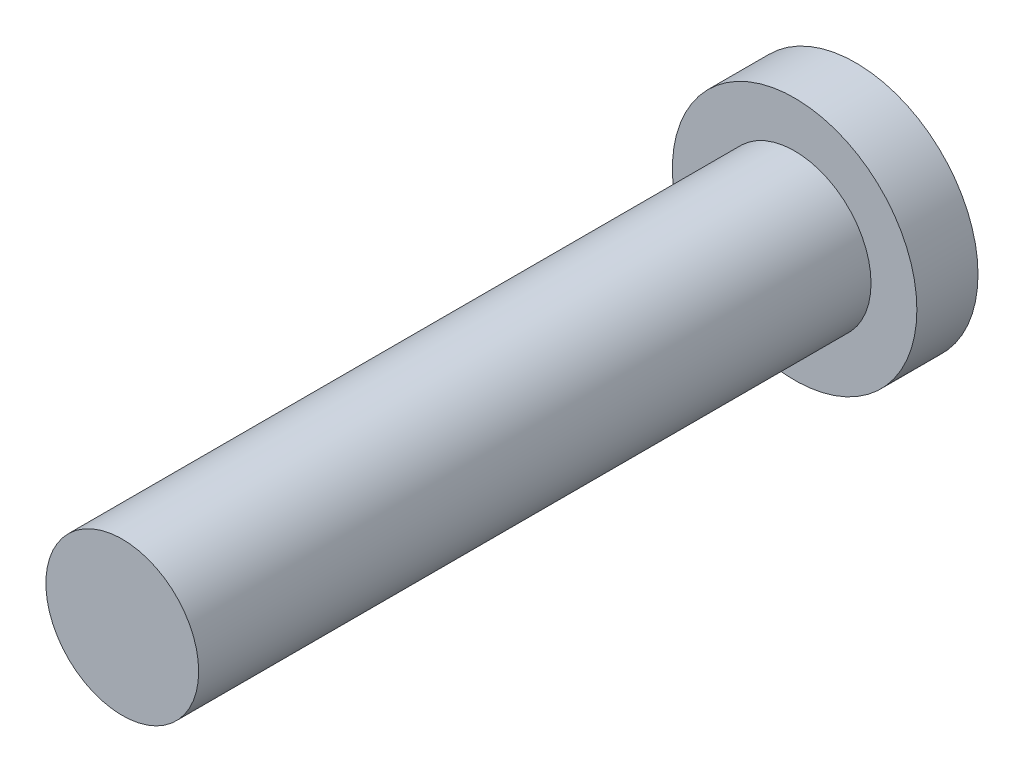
SolidWorks part; units mm, degrees
ref_plane "Face" through (0, 0, 0) normal (0, 0, 1) x (1, 0, 0)
ref_plane "Dessus" through (0, 0, 0) normal (0, 1, 0) x (1, 0, 0)
ref_plane "Droite" through (0, 0, 0) normal (1, 0, 0) x (0, 0, -1)
sketch "Esquisse1" plane through (0, 0, 0) normal (0, 0, 1) x (1, 0, 0)
  circle A0 centre (0, 0) radius 2
  dimension "D1" = 4
extrude "Base-Extrusion" add sketch "Esquisse1" along normal blind 1
sketch "Esquisse2" plane through (0, 0, 1) normal (0, 0, 1) x (1, 0, 0)
  circle A0 centre (0, 0) radius 1.25
  dimension "D1" = 2.5
extrude "Boss.-Extru.1" add sketch "Esquisse2" along normal blind 11
